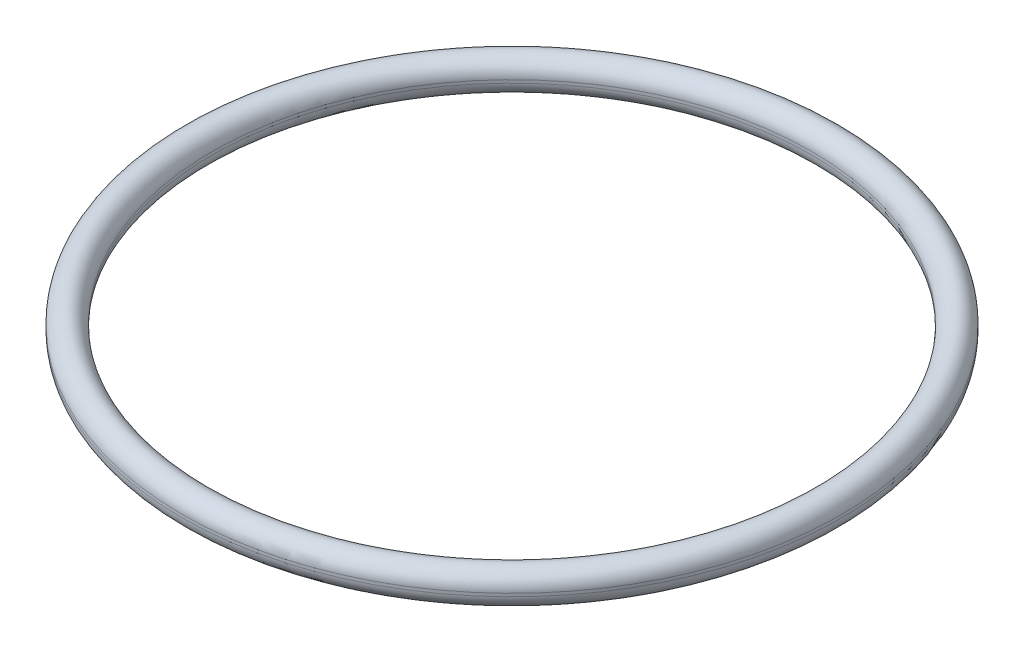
SolidWorks part; units mm, degrees
ref_plane "Front Plane" through (0, 0, 0) normal (0, 0, 1) x (1, 0, 0)
ref_plane "Top Plane" through (0, 0, 0) normal (0, 1, 0) x (1, 0, 0)
ref_plane "Right Plane" through (0, 0, 0) normal (1, 0, 0) x (0, 0, -1)
sketch "Sketch1" plane through (0, 0, 0) normal (0, 0, 1) x (1, 0, 0)
  line L0 (0, 0) -> (0, 40.393) construction
  line L1 (12.6683, 0) -> (12.6683, 0.127)
  line L2 (13.9383, 0.127) -> (13.9382, 0)
  arc A0 (12.6683, 0.127) -> (13.9383, 0.127) centre (13.3033, 0.127) cw
  arc A1 (13.9382, 0) -> (12.6683, 0) centre (13.3033, 0) cw
  dimension "D1" = 25.3365
  dimension "D2" = 27.8765
  dimension "D3" = 0.127
revolve "Revolve1" add sketch "Sketch1" angle 360 about L0
